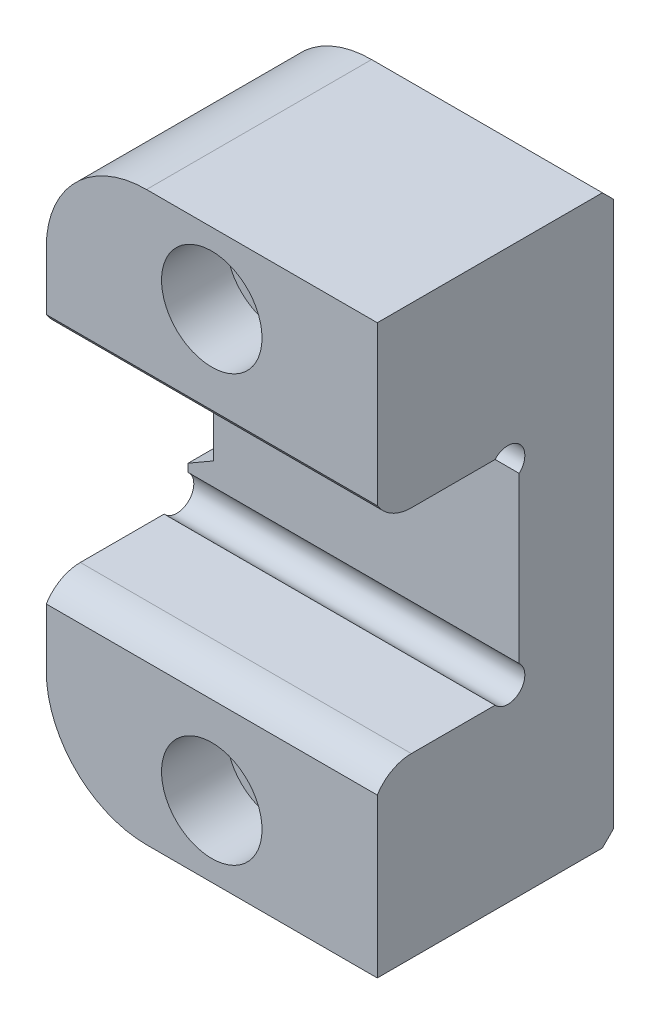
SolidWorks part; units mm, degrees
ref_plane "Front Plane" through (0, 0, 0) normal (0, 0, 1) x (1, 0, 0)
ref_plane "Top Plane" through (0, 0, 0) normal (0, 1, 0) x (1, 0, 0)
ref_plane "Right Plane" through (0, 0, 0) normal (1, 0, 0) x (0, 0, -1)
sketch "Sketch1" plane through (0, 0, 0) normal (1, 0, 0) x (0, 0, -1)
  line L0 (0, 0) -> (50000, 0) construction
  line L1 (0, 14.2875) -> (19.05, 14.2875)
  line L2 (0, 38.1) -> (31.75, 38.1)
  line L3 (0, 38.1) -> (0, 14.2875)
  line L4 (0, -38.1) -> (31.75, -38.1)
  line L5 (31.75, 38.1) -> (31.75, -38.1)
  line L6 (19.05, 14.2875) -> (19.05, -14.2875)
  line L7 (19.05, -14.2875) -> (0, -14.2875)
  line L9 (0, 24.4475) -> (0, -24.4475) construction
  line L10 (0, -14.2875) -> (0, -38.1)
  dimension "D1" = 31.75
  dimension "D2" = 76.2
  dimension "D3" = 19.05
  dimension "D4" = 28.575
extrude "Extrude1" add sketch "Sketch1" along normal mid plane 44.45
fillet "Fillet1" radius 13.462 2 edges at (-22.225, -38.1, -15.875) (-22.225, 38.1, -15.875)
sketch "Sketch2" plane through (-9.525, 0, -31.75) normal (0, 0, 1) x (1, 0, 0)
  line L0 (0, 0) -> (50000, 0) construction
  line L1 (31.75, -38.1) -> (31.75, 38.1) construction
  line L2 (29.3687, 8.6085) -> (32.5437, 10.4415) construction
  line L3 (29.3687, 8.6085) -> (29.3687, -8.6085) construction
  line L4 (29.3687, -8.6085) -> (32.5437, -10.4415) construction
  line L5 (32.5437, 10.4415) -> (32.5437, -10.4415) construction
  line L6 (9.525, 0) -> (9.525, 50000) construction
  line L7 (-13.4938, 10.4415) -> (-13.4938, -10.4415)
  line L8 (-10.3188, -8.6085) -> (-13.4938, -10.4415)
  line L9 (-10.3188, 8.6085) -> (-10.3188, -8.6085)
  line L10 (-10.3188, 8.6085) -> (-13.4938, 10.4415)
  point P4 (30.9562, 9.525)
  point P10 (30.9562, -9.525)
  point P13 (-11.9063, -9.525)
  point P14 (-11.9063, 9.525)
  dimension "D1" = 19.05
  dimension "D2" = 2.3813
  dimension "D3" = 30
  dimension "D4" = 3.175
extrude "Cut-Extrude1" cut sketch "Sketch2" along normal through all
sketch "Sketch5" plane through (22.225, 0, 0) normal (1, 0, 0) x (0, 0, -1)
  line L0 (0, 0) -> (50000, 0) construction
  line L2 (0, 38.1) -> (0, 14.2875) construction
  line L3 (0, -14.2875) -> (0, -38.1) construction
  line L4 (-1.778, -13.6525) -> (4.572, -13.6525)
  line L5 (-1.778, -13.6525) -> (-1.778, -16.8275)
  line L6 (-1.778, -16.8275) -> (0, -16.8275)
  line L7 (4.572, -13.6525) -> (4.572, -14.2875)
  line L8 (19.05, -14.2875) -> (0, -14.2875) construction
  line L9 (4.572, 13.6525) -> (4.572, 14.2875)
  line L10 (-1.778, 16.8275) -> (0, 16.8275)
  line L11 (-1.778, 13.6525) -> (-1.778, 16.8275)
  line L12 (-1.778, 13.6525) -> (4.572, 13.6525)
  arc A0 (1.7842, -14.5973) -> (4.572, -14.2875) centre (4.572, -26.9875) cw construction
  arc A1 (0, -16.8275) -> (1.7842, -14.5973) centre (2.286, -16.8275) cw construction
  arc A2 (0, 16.8275) -> (1.7842, 14.5973) centre (2.286, 16.8275) ccw construction
  arc A3 (1.7842, 14.5973) -> (4.572, 14.2875) centre (4.572, 26.9875) ccw construction
  arc A4 (0, -16.8275) -> (4.572, -14.2875) centre (4.572, -19.6723) cw
  arc A5 (0, 16.8275) -> (4.572, 14.2875) centre (4.572, 19.6723) ccw
  dimension "D1" = 2.286
  dimension "D2" = 12.7
  dimension "D3" = 3.175
  dimension "D4" = 6.35
  dimension "D5" = 4.572
extrude "Cut-Extrude2" cut sketch "Sketch5" against normal through all
sketch "Sketch6" plane through (22.225, 0, 0) normal (1, 0, 0) x (0, 0, -1)
  line L0 (0, 0) -> (50000, 0) construction
  line L3 (19.05, 14.2875) -> (19.05, -14.2875) construction
  line L4 (4.572, 14.2875) -> (19.05, 14.2875) construction
  circle A0 centre (17.526, 12.7635) radius 2.286
  circle A1 centre (17.526, -12.7635) radius 2.286
  dimension "D2" = 0.762
  dimension "D3" = 2.286
  dimension "D1" = 0.762
extrude "Cut-Extrude3" cut sketch "Sketch6" against normal through all
hole_wizard "5/16\"-18 CBORE" positions "Sketch4" profile "Sketch3" counterbore size "5/16" standard "Ansi Inch"
sketch "Sketch4" plane through (0, 0, 0) normal (0, 0, 1) x (1, 0, 0)
  line L0 (0, 0) -> (0, 50000) construction
  line L1 (0, 0) -> (50000, 0) construction
  point P0 (0, 28.575)
  point P12 (0, -28.575)
  dimension "D1" = 57.15
sketch "Sketch3" plane through (0, 28.575, 0) normal (1, 0, 0) x (0, -1, 0)
  line L0 (0, 0) -> (0, 31.75)
  line L1 (0, 31.75) -> (4.365, 31.75)
  line L3 (4.365, 31.75) -> (4.365, 8.7312)
  line L4 (4.365, 8.7312) -> (6.7475, 8.7312)
  line L5 (6.7475, 8.7312) -> (6.7475, 0)
  line L7 (6.7475, 0) -> (0, 0)
  line L11 (0, -6.35) -> (0, 107.95) construction
  dimension "Thru Hole Dia." = 8.73
  dimension "Thru Hole Depth" = 31.75
  dimension "C'Bore Dia." = 13.495
  dimension "C'Bore Depth" = 8.7312
chamfer "Chamfer3" distance 3.81 angle 15 1 edges at (-19.8437, 0, -19.05)
chamfer "Chamfer1" distance 1.524 angle 45 6 edges at (-22.225, -17.3106, -31.75) (-18.2821, -34.1571, -31.75) (6.731, -38.1, -31.75) (6.731, 38.1, -31.75) (-22.225, 17.3106, -31.75) (-18.2821, 34.1571, -31.75)
